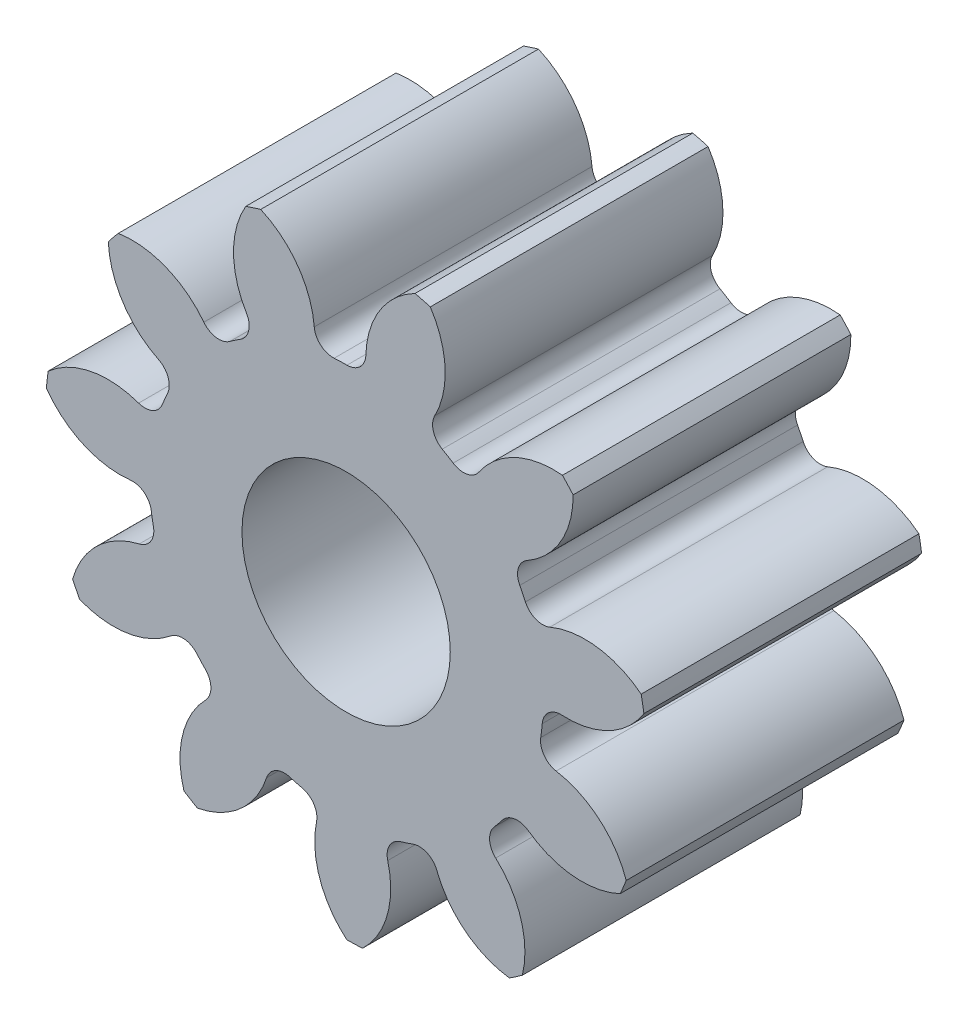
SolidWorks part; units mm, degrees
ref_plane "Front" through (0, 0, 0) normal (0, 0, 1) x (1, 0, 0)
ref_plane "Top" through (0, 0, 0) normal (0, 1, 0) x (1, 0, 0)
ref_plane "Right" through (0, 0, 0) normal (1, 0, 0) x (0, 0, -1)
sketch "Sketch3" plane through (0, 0, 0) normal (0, 0, 1) x (1, 0, 0)
  circle A0 centre (0, 0) radius 110.0667
  dimension "od" = 220.1333
extrude "gearBody" add sketch "Sketch3" along normal blind 101.6
sketch "Sketch2" plane through (0, 0, 0) normal (0, 0, 1) x (1, 0, 0)
  line L0 (0, 0) -> (80.8549, 33.4912) construction
  line L1 (103.1332, -42.3997) -> (0, 0) construction
  line L2 (0, 0) -> (36.3143, 0) construction
  line L3 (93.0939, 2.7114) -> (90.0467, -23.7782) construction
  line L5 (91.5703, -10.5334) -> (0, 0) construction
  line L7 (0, 0) -> (87.5167, 0) construction
  arc A0 (87.5105, 1.0429) -> (84.988, -20.8855) centre (0, 0) ccw construction
  arc A1 (108.9139, 15.8878) -> (102.4618, -40.2026) centre (0, 0) ccw construction
  arc A2 (93.0939, 2.7114) -> (90.0467, -23.7782) centre (0, 0) ccw construction
  arc A3 (71.1901, -10.5437) -> (71.7247, -5.8959) centre (0, 0) ccw
  arc A4 (103.1332, -42.3997) -> (76.8246, -18.343) centre (71.1387, -50.9751) ccw
  arc A5 (103.1332, -42.3997) -> (110.0667, 17.8751) centre (0, 0) ccw
  arc A6 (110.0667, 17.8751) -> (78.9829, 0.4203) centre (80.8549, 33.4912) cw
  arc A7 (71.7247, -5.8959) -> (78.9829, 0.4203) centre (78.5934, -6.4606) cw
  arc A8 (76.8246, -18.343) -> (71.1901, -10.5437) centre (78.0076, -11.5534) cw
  point P6 (110.0667, 17.8751)
  point P22 (103.1332, -42.3997)
  dimension "baseDia" = 175.0334
  dimension "od" = 220.1333
  dimension "pd" = 186.2667
  dimension "rd" = 143.9333
  dimension "rFillet" = 6.8919
  dimension "pointX" = 110.0667
  dimension "pointY" = 17.8751
  dimension "CTT" = 26.4896
  dimension "flankCenterAngle" = 22.5
extrude "toothCut" cut sketch "Sketch2" along normal through all
pattern_circular "CirPattern1" count 11 over 360 about axis through (0, 0, 0) along (0, 0, 1) of "toothCut"
sketch "hub1Dia" plane through (0, 0, 0) normal (0, 0, -1) x (-1, 0, 0)
  circle A0 centre (0, 0) radius 12.7
  dimension "hub1Dia" = 25.4
sketch "hub2Dia" plane through (0, 0, 101.6) normal (0, 0, 1) x (1, 0, 0)
  circle A0 centre (0, 0) radius 12.7
  dimension "hub2dia" = 25.4
sketch "boreDia" plane through (0, 0, 0) normal (0, 0, 1) x (1, 0, 0)
  circle A0 centre (0, 0) radius 38.1
  dimension "boreDia" = 76.2
extrude "bore" cut sketch "boreDia" against normal mid plane 25400
